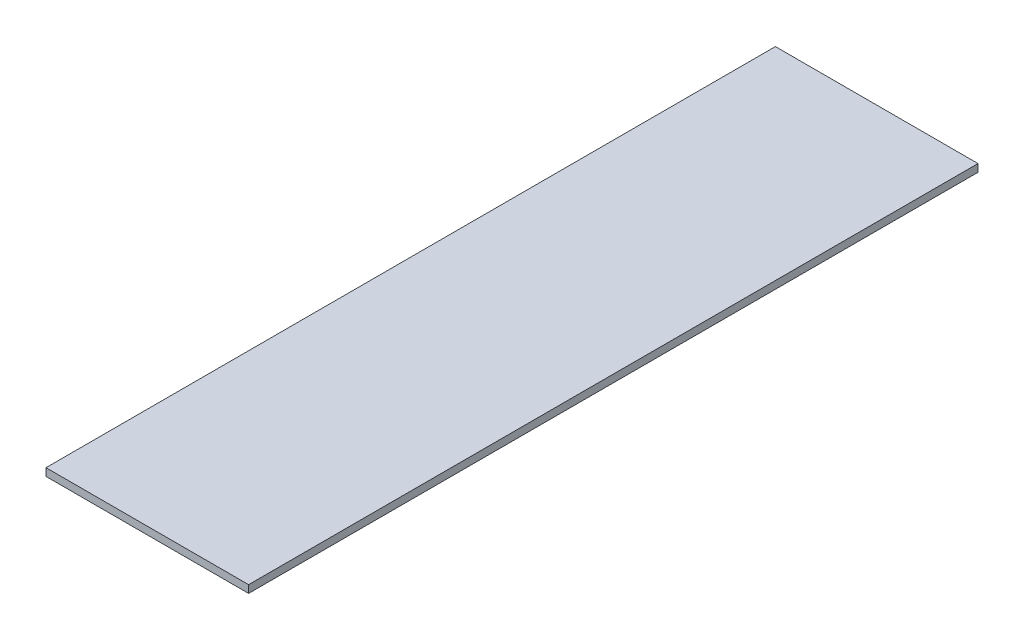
SolidWorks part; units mm, degrees
ref_plane "Front Plane" through (0, 0, 0) normal (0, 0, 1) x (1, 0, 0)
ref_plane "Top Plane" through (0, 0, 0) normal (0, 1, 0) x (1, 0, 0)
ref_plane "Right Plane" through (0, 0, 0) normal (1, 0, 0) x (0, 0, -1)
sketch "Sketch1" plane through (0, 0, 0) normal (0, 1, 0) x (1, 0, 0)
  line L1 (0, 0) -> (127, 0)
  line L2 (0, 0) -> (0, 457.2)
  line L3 (0, 457.2) -> (127, 457.2)
  line L4 (127, 0) -> (127, 457.2)
  dimension "D1" = 127
  dimension "D2" = 457.2
extrude "Boss-Extrude1" add sketch "Sketch1" along normal blind 4.7625
sketch "Sketch2" plane through (0, 0, 0) normal (0, 0, 1) x (1, 0, 0)
  line L0 (0, 4.7625) -> (127, 4.7625) construction
  line L1 (2.54, 4.445) -> (7.62, 4.445)
  line L2 (2.54, 4.445) -> (2.54, 0.3175)
  line L3 (2.54, 0.3175) -> (7.62, 0.3175)
  line L4 (7.62, 4.445) -> (7.62, 0.3175)
  line L5 (0, 0) -> (127, 0) construction
  line L8 (0, 4.7625) -> (0, 0) construction
  dimension "D1" = 0.3175
  dimension "D2" = 0.3175
  dimension "D3" = 2.54
  dimension "D4" = 5.08
extrude "Cut-Extrude3" [suppressed] cut sketch "Sketch2" against normal through all
pattern_linear "LPattern1" [suppressed] count 23 spacing 5.3975 count 2 spacing 5.3975
